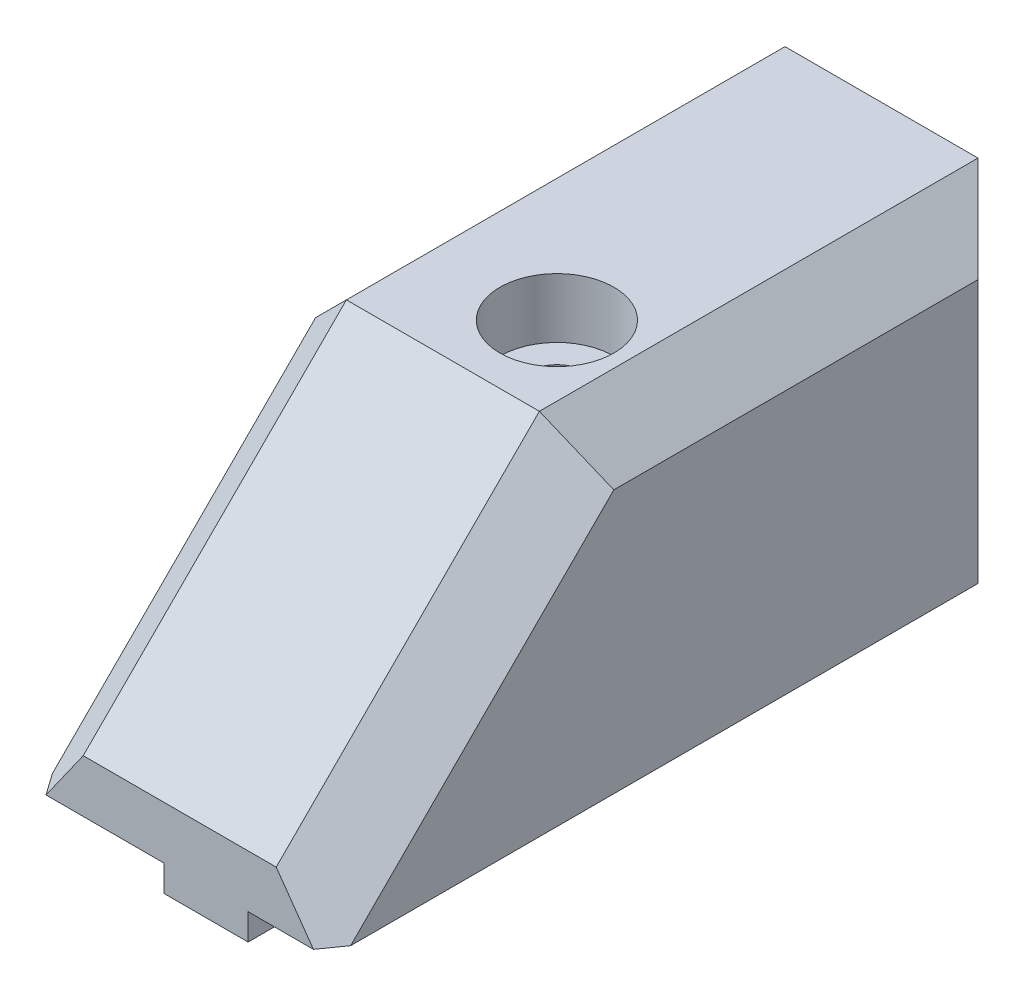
SolidWorks part; units mm, degrees
other "<Spannklotz>-<Fase1>"
ref_plane "Ebene vorne" through (0, 0, 0) normal (0, 0, 1) x (1, 0, 0)
ref_plane "Ebene oben" through (0, 0, 0) normal (0, 1, 0) x (1, 0, 0)
ref_plane "Ebene rechts" through (0, 0, 0) normal (1, 0, 0) x (0, 0, -1)
ref_plane "Aufriss-Spannklotz_Gespiegelt" through (17, 0, 0) normal (0, 0, 1) x (-1, 0, 0)
ref_plane "Grundriss-Spannklotz_Gespiegelt" through (17, 0, 0) normal (0, 1, 0) x (-1, 0, 0)
ref_plane "Seitenriss-Spannklotz_Gespiegelt" through (17, 0, 0) normal (-1, 0, 0) x (0, 0, -1)
mirrored part "Spannklotz_Gespiegelt" parameters "D1.Aufsatz-Linear austragen1"=18, "D1.Skizze1"=17, "D2.Skizze1"=40, "D1.Aufsatz-Linear austragen2"=1.5, "D1.Skizze2"=4.8, "D2.Skizze2"=10, "Bohrerdurchmesser.Skizze4"=3.4, "Bohrungstiefe.Skizze4"=19.5, "Senkdurchmesser2.Skizze4"=6.5, "Senktiefe2.Skizze4"=3.4, "D1.Skizze3"=10, "Bohrerdurchmesser.Skizze6"=5.6, "Bohrungstiefe.Skizze6"=15, "Spitzenwinkel.Skizze6"=180, "D1.Skizze5"=12, "D1.Skizze9"=3, "D2.Skizze9"=45, "D1.Fase1"=3, "D2.Fase1"=45
